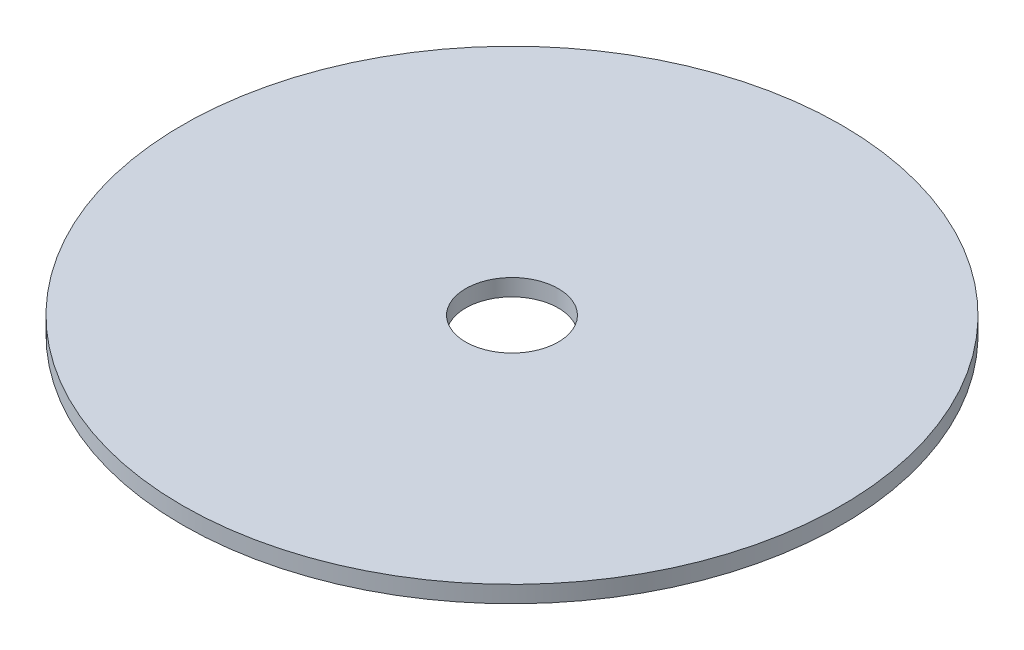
SolidWorks part; units mm, degrees
ref_plane "Front Plane" through (0, 0, 0) normal (0, 0, 1) x (1, 0, 0)
ref_plane "Top Plane" through (0, 0, 0) normal (0, 1, 0) x (1, 0, 0)
ref_plane "Right Plane" through (0, 0, 0) normal (1, 0, 0) x (0, 0, -1)
sketch "Sketch1" plane through (0, 0, 0) normal (0, 1, 0) x (1, 0, 0)
  circle A0 centre (0, 0) radius 3.5687
  circle A1 centre (0, 0) radius 25.4
  dimension "D1" = 7.1374
  dimension "D2" = 50.8
extrude "Boss-Extrude1" add sketch "Sketch1" along normal blind 1.2954
